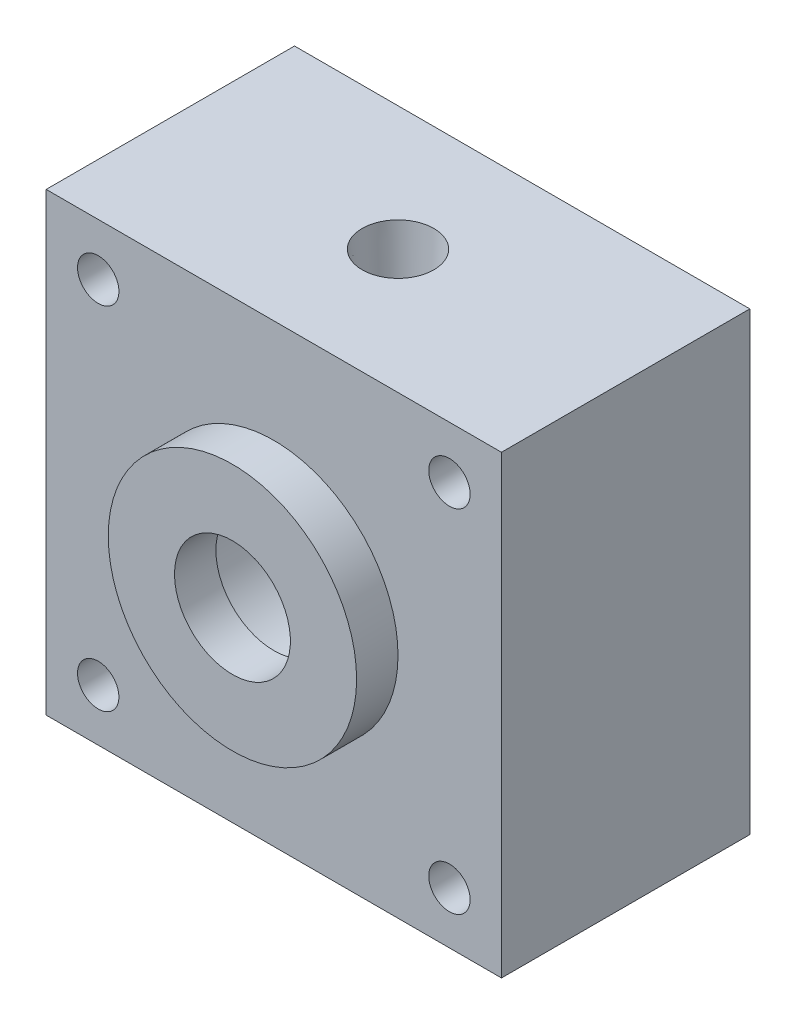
SolidWorks part; units mm, degrees
ref_plane "Front" through (0, 0, 0) normal (0, 0, 1) x (1, 0, 0)
ref_plane "Top" through (0, 0, 0) normal (0, 1, 0) x (1, 0, 0)
ref_plane "Right" through (0, 0, 0) normal (1, 0, 0) x (0, 0, -1)
sketch "Sketch1" plane through (0, 0, 0) normal (0, 0, 1) x (1, 0, 0)
  line L0 (-17.4625, 17.4625) -> (17.4625, 17.4625)
  line L1 (-17.4625, 17.4625) -> (-17.4625, -17.4625)
  line L2 (17.4625, -17.4625) -> (-17.4625, -17.4625)
  line L3 (17.4625, -17.4625) -> (17.4625, 17.4625)
  line L4 (17.4625, 17.4625) -> (-17.4625, -17.4625) construction
  dimension "D1" = 34.925
extrude "Base-Extrude" add sketch "Sketch1" along normal blind 19.05
sketch "Sketch12" plane through (-5.9785, 12.8213, 0) normal (0, 0, -1) x (-1, 0, 0)
  circle A0 centre (-5.9785, -12.8213) radius 14.2875
  circle A1 centre (-5.9785, -12.8213) radius 15.875
  dimension "D1" = 28.575
  dimension "D2" = 31.75
extrude "Cut-Extrude4" cut sketch "Sketch12" against normal blind 1.524
sketch "Sketch3" plane through (0, 0, 19.05) normal (0, 0, 1) x (1, 0, 0)
  line L0 (0, 0) -> (17.4625, 17.4625) construction
  circle A0 centre (13.4704, 13.4704) radius 1.5875
  circle A1 centre (0, 0) radius 19.05 construction
  dimension "D1" = 3.175
  dimension "D2" = 38.1
extrude "Cut-Extrude2" cut sketch "Sketch3" against normal through all
pattern_circular "CirPattern2" count 4 every 90 about axis through (0, 0, 0) along (0, 0, 1) of "Cut-Extrude2"
hole_wizard "Hole3" positions "Sketch9" profile "Sketch10" legacy
sketch "Sketch9" plane through (5.4711, 17.4625, 3.5795) normal (0, 1, 0) x (-1, 0, 0)
  line L1 (5.4711, 5.9455) -> (22.9336, 5.9455) construction
  line L3 (22.9336, 15.4705) -> (22.9336, -3.5795) construction
  line L4 (5.4711, -2.0555) -> (5.4711, -3.5795) construction
  point P0 (5.4711, 5.9455)
sketch "Sketch10" plane through (0, 17.4625, 9.525) normal (1, 0, 0) x (0, 0, 1)
  line L0 (0, 0) -> (0, 7.7999)
  line L1 (0, 7.7999) -> (2.413, 6.35)
  line L2 (2.413, 6.35) -> (2.413, 4.826)
  line L4 (2.7505, 0) -> (0, 0)
  line L5 (0, -4.0065) -> (0, 25.3083) construction
  line L6 (0, 7.7999) -> (-2.413, 6.35) construction
  line L7 (2.413, 4.826) -> (2.7505, 0)
  dimension "Depth" = 6.35
  dimension "Drill Angle" = 118
  dimension "Diameter" = 4.826
sketch "Sketch15" plane through (0, 0, 19.05) normal (0, 0, 1) x (1, 0, 0)
  circle A0 centre (0, 0) radius 9.525
  dimension "D1" = 19.05
extrude "Boss-Extrude1" add sketch "Sketch15" along normal blind 3.175
sketch "Sketch14" plane through (0, 0, 0) normal (0, 0, -1) x (-1, 0, 0)
  circle A0 centre (0, 0) radius 4.445
  dimension "D1" = 8.89
extrude "Cut-Extrude6" cut sketch "Sketch14" against normal through all
sketch "Sketch16" plane through (0, 0, 0) normal (0, 0, -1) x (-1, 0, 0)
  circle A0 centre (0, 0) radius 6.35
  dimension "D1" = 12.7
extrude "Cut-Extrude7" cut sketch "Sketch16" against normal up to surface (19.05 mm away)
sketch "Sketch17" plane through (0, 0, 0) normal (1, 0, 0) x (0, 0, -1)
  line L0 (-9.525, 11.1125) -> (-1.9489, -2.0097) construction
  line L1 (-9.525, 11.1125) -> (-9.525, 9.6626) construction
  line L2 (-9.525, 11.1125) -> (-10.5149, 10.541)
  line L3 (-11.938, 11.1125) -> (-7.112, 11.1125) construction
  line L4 (-10.5149, 10.541) -> (-4.0991, -0.5715)
  line L5 (-4.0991, -0.5715) -> (-3.1092, 0)
  line L6 (-3.1092, 0) -> (-9.525, 11.1125)
  line L7 (0, 0) -> (-24.9573, 0) construction
  line L8 (-22.225, 0) -> (-19.05, 0) construction
  dimension "D1" = 2.286
  dimension "D2" = 60
revolve "Cut-Revolve1" cut sketch "Sketch17" angle 360 about L0
